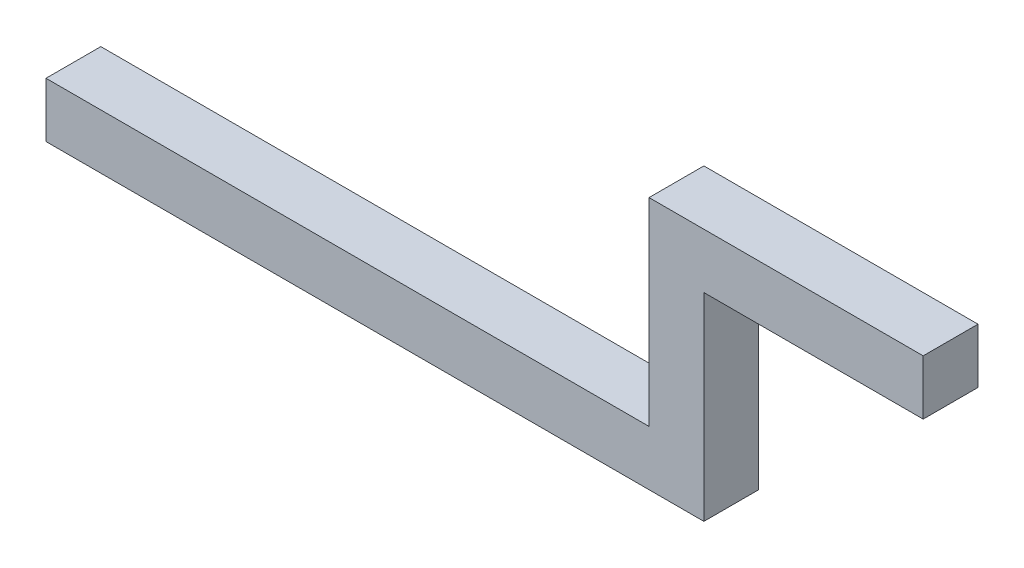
SolidWorks part; units mm, degrees
ref_plane "Front Plane" through (0, 0, 0) normal (0, 0, 1) x (1, 0, 0)
ref_plane "Top Plane" through (0, 0, 0) normal (0, 1, 0) x (1, 0, 0)
ref_plane "Right Plane" through (0, 0, 0) normal (1, 0, 0) x (0, 0, -1)
sketch "Sketch1" plane through (0, 0, 0) normal (0, 0, 1) x (1, 0, 0)
  line L0 (0, 23.2878) -> (0, 46.2455)
  line L1 (-69.85, 23.2878) -> (0, 23.2878)
  line L2 (-69.85, 23.2878) -> (-69.85, 16.9378)
  line L3 (-69.85, 16.9378) -> (6.35, 16.9378)
  line L4 (6.35, 23.2878) -> (6.35, 16.9378)
  line L5 (-69.85, 23.2878) -> (6.35, 16.9378) construction
  line L6 (-69.85, 16.9378) -> (-16.8084, 18.8677) construction
  line L7 (0, 46.2455) -> (31.75, 46.2455)
  line L8 (6.35, 23.2878) -> (6.35, 39.8955)
  line L9 (6.35, 39.8955) -> (31.75, 39.8955)
  line L10 (31.75, 39.8955) -> (31.75, 46.2455)
  point P0 (-16.8084, 18.8677)
  dimension "D1" = 76.2
  dimension "D2" = 6.35
  dimension "D3" = 6.35
  dimension "D4" = 6.35
  dimension "D5" = 31.75
extrude "Boss-Extrude1" add sketch "Sketch1" along normal blind 6.35
